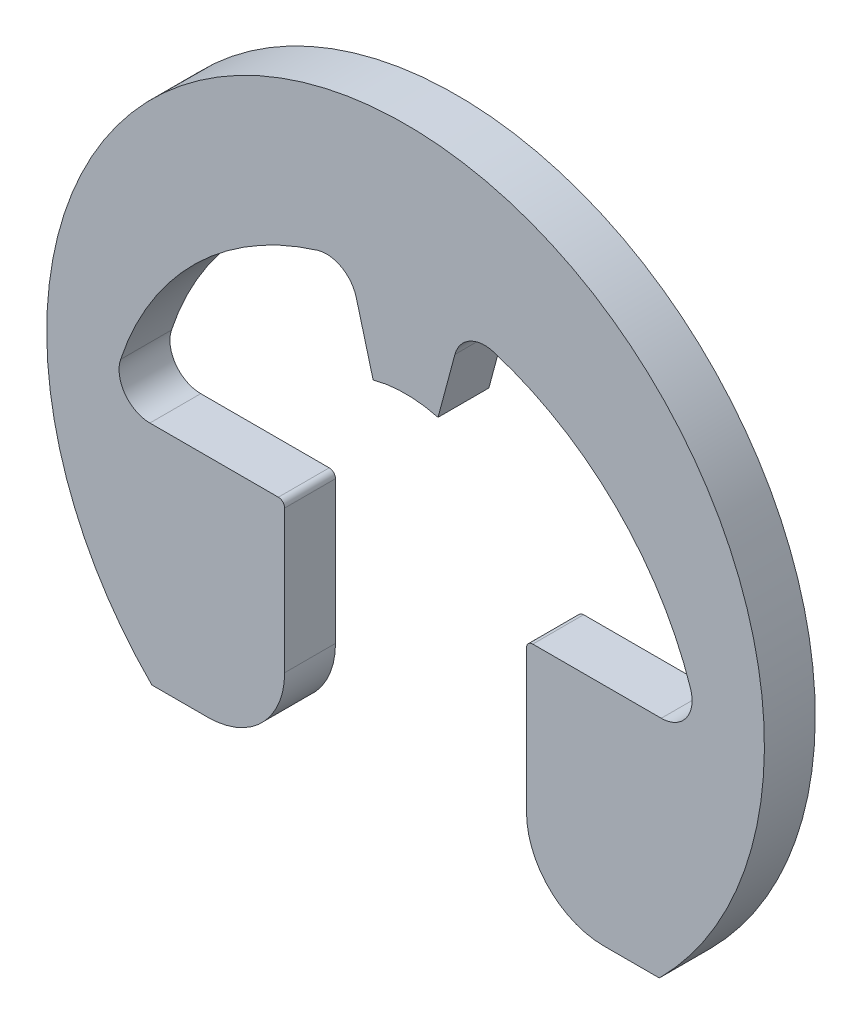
SolidWorks part; units mm, degrees
ref_plane "Plane1" through (0, 0, 0) normal (0, 0, 1) x (1, 0, 0)
ref_plane "Plane2" through (0, 0, 0) normal (0, 1, 0) x (1, 0, 0)
ref_plane "Plane3" through (0, 0, 0) normal (1, 0, 0) x (0, 0, -1)
sketch "Clipboard" plane through (0, 0, 0) normal (0, 0, 1) x (1, 0, 0)
  line L0 (0, 0) -> (1.0494, 0)
  circle A0 centre (0, 0) radius 0.9144
  circle A1 centre (0, 0) radius 2.6162
  dimension "FreeID" = 1.8288
  dimension "FreeOD" = 5.2324
  dimension "LargeSection" = 1.0494
sketch "BodySke" plane through (0, 0, 0) normal (0, 0, 1) x (1, 0, 0)
  line L0 (-2.1642, 0) -> (2.1642, 0) construction
  line L1 (0, 0) -> (0, 1.6394) construction
  line L2 (0, 0) -> (0.1962, 0.7323) construction
  line L3 (0, 0) -> (2.5973, -0.6959) construction
  line L4 (0, 0) -> (-0.1962, 0.7323) construction
  line L5 (0, 0) -> (-2.5973, -0.6959) construction
  line L6 (0, 0) -> (1.9013, -1.9013) construction
  line L7 (0, 0) -> (-1.9013, -1.9013) construction
  line L8 (1.9013, -1.9013) -> (1.4834, -1.9013)
  line L9 (-1.4834, -1.9013) -> (-1.9013, -1.9013)
  line L10 (0.9532, -0.2084) -> (1.916, -0.2084)
  line L11 (0.3696, 1.3793) -> (0.2432, 0.9078)
  line L12 (-0.3696, 1.3793) -> (-0.2432, 0.9078)
  line L13 (0.9062, -0.2554) -> (0.9062, -1.3241)
  line L14 (-0.9532, -0.2084) -> (-1.916, -0.2084)
  line L15 (-0.9062, -0.2554) -> (-0.9062, -1.3241)
  circle A0 centre (0, 0) radius 0.9398 construction
  arc A1 (2.1642, 0) -> (-2.1642, 0) centre (0, -0.6087) ccw construction
  arc A2 (1.9013, -1.9013) -> (-1.9013, -1.9013) centre (0, 0) ccw
  arc A3 (0.9532, -0.2084) -> (0.9062, -0.2554) centre (0.9532, -0.2554) ccw
  arc A4 (-0.9062, -0.2554) -> (-0.9532, -0.2084) centre (-0.9532, -0.2554) ccw
  arc A5 (-2.1352, 0.0947) -> (-0.6604, 1.5402) centre (0, -0.6087) cw
  arc A6 (-0.2432, 0.9078) -> (0.2432, 0.9078) centre (0, 0) cw
  arc A7 (0.6604, 1.5402) -> (2.1352, 0.0947) centre (0, -0.6087) cw
  arc A8 (1.916, -0.2084) -> (2.1352, 0.0947) centre (1.916, 0.0225) ccw
  arc A9 (0.6604, 1.5402) -> (0.3696, 1.3793) centre (0.5926, 1.3195) ccw
  arc A10 (-0.3696, 1.3793) -> (-0.6604, 1.5402) centre (-0.5926, 1.3195) ccw
  arc A11 (-2.1352, 0.0947) -> (-1.916, -0.2084) centre (-1.916, 0.0225) ccw
  arc A12 (0.9062, -1.3241) -> (1.4834, -1.9013) centre (1.4834, -1.3241) ccw
  arc A13 (-1.4834, -1.9013) -> (-0.9062, -1.3241) centre (-1.4834, -1.3241) ccw
  dimension "D1" = 15
  dimension "GrooveDia" = 1.8796
  dimension "OutsideDia" = 5.3777
  dimension "D3" = 30
  dimension "CavityFilletRad" = 0.2309
  dimension "InnerTipRad" = 0.047
  dimension "OuterTipRadius" = 0.5772
  dimension "CavityWidth" = 4.3283
  dimension "CavityHeight" = 1.6394
extrude "Body" add sketch "BodySke" against normal blind 0.381
equation "' \"FreeID@Clipboard\" = 0.072"
equation "' \"Thickness@Body\" = 0.015"
equation "' \"GrooveDia@BodySke\" = 0.074"
equation "' \"FreeOD@Clipboard\" = 0.206"
equation "' \"FreeID@Clipboard\" = 0.430"
equation "' \"Thickness@Body\" = 0.042"
equation "' \"GrooveDia@BodySke\" = 0.437"
equation "' \"FreeOD@Clipboard\" = 0.870"
equation "\"OutsideDia@BodySke\" = ( \"GrooveDia@BodySke\"  /  \"FreeID@Clipboard\" )  * \"FreeOD@Clipboard\""
equation "\"LargeSection@Clipboard\" =  (\"OutsideDia@BodySke\" - \"GrooveDia@BodySke\") / 2 * 0.6"
equation "\"CavityHeight@BodySke\" = \"OutsideDia@BodySke\"  /  2 - \"LargeSection@Clipboard\""
equation "\"CavityWidth@BodySke\" = \"OutsideDia@BodySke\" -  \"LargeSection@Clipboard\""
equation "\"CavityFilletRad@BodySke\" =  (\"CavityHeight@BodySke\" * 2 - \"GrooveDia@BodySke\") / 2 * 0.33"
equation "\"InnerTipRad@BodySke\" = \"GrooveDia@BodySke\" * 0.025"
equation "\"OuterTipRadius@BodySke\" =  (\"OutsideDia@BodySke\" - \"GrooveDia@BodySke\") / 2 * 0.33"
